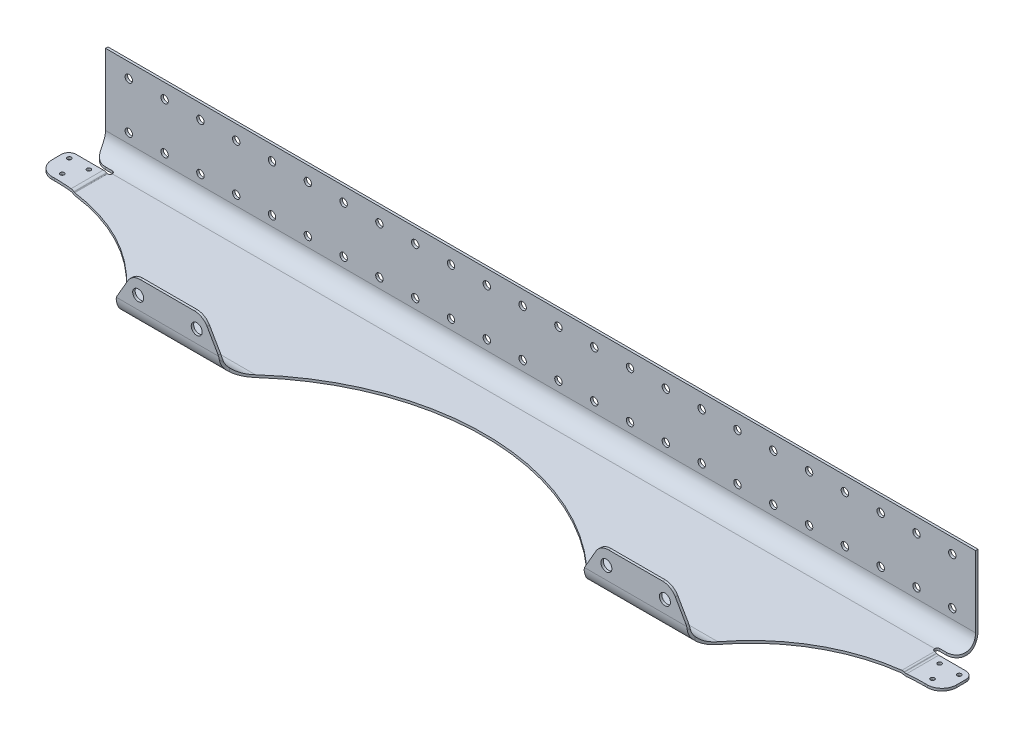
SolidWorks part; units mm, degrees
ref_plane "Front Plane" through (0, 0, 0) normal (1, 0, 0) x (0, 1, 0)
ref_plane "Top Plane" through (0, 0, 0) normal (0, 0, 1) x (0, 1, 0)
ref_plane "Right Plane" through (0, 0, 0) normal (0, 1, 0) x (-1, 0, 0)
sketch "sk 5dia hole pat" plane through (0, 0, 0) normal (0, 0, 1) x (0, 1, 0)
  line L4 (-30.48, -48.26) -> (30.48, -48.26) construction
  point P3 (0, -48.26)
  circle B0 centre (30.48, -579.12) radius 4.826
  circle B1 centre (1188.72, 579.12) radius 4.826
  circle B2 centre (78.74, -579.12) radius 4.826
  circle B3 centre (127, -579.12) radius 4.826
  circle B4 centre (175.26, -579.12) radius 4.826
  circle B5 centre (223.52, -579.12) radius 4.826
  circle B6 centre (271.78, -579.12) radius 4.826
  circle B7 centre (320.04, -579.12) radius 4.826
  circle B8 centre (368.3, -579.12) radius 4.826
  circle B9 centre (416.56, -579.12) radius 4.826
  circle B10 centre (464.82, -579.12) radius 4.826
  circle B11 centre (513.08, -579.12) radius 4.826
  circle B12 centre (561.34, -579.12) radius 4.826
  circle B13 centre (609.6, -579.12) radius 4.826
  circle B14 centre (657.86, -579.12) radius 4.826
  circle B15 centre (706.12, -579.12) radius 4.826
  circle B16 centre (754.38, -579.12) radius 4.826
  circle B17 centre (802.64, -579.12) radius 4.826
  circle B18 centre (850.9, -579.12) radius 4.826
  circle B19 centre (899.16, -579.12) radius 4.826
  circle B20 centre (947.42, -579.12) radius 4.826
  circle B21 centre (995.68, -579.12) radius 4.826
  circle B22 centre (1043.94, -579.12) radius 4.826
  circle B23 centre (1092.2, -579.12) radius 4.826
  circle B24 centre (1140.46, -579.12) radius 4.826
  circle B25 centre (1188.72, -579.12) radius 4.826
  circle B26 centre (30.48, -530.86) radius 4.826
  circle B27 centre (30.48, -482.6) radius 4.826
  circle B28 centre (30.48, -434.34) radius 4.826
  circle B29 centre (30.48, -386.08) radius 4.826
  circle B30 centre (30.48, -337.82) radius 4.826
  circle B31 centre (30.48, -289.56) radius 4.826
  circle B32 centre (30.48, -241.3) radius 4.826
  circle B33 centre (30.48, -193.04) radius 4.826
  circle B34 centre (30.48, -144.78) radius 4.826
  circle B35 centre (30.48, -96.52) radius 4.826
  circle B36 centre (30.48, -48.26) radius 4.826
  circle B37 centre (30.48, 0) radius 4.826
  circle B38 centre (30.48, 48.26) radius 4.826
  circle B39 centre (30.48, 96.52) radius 4.826
  circle B40 centre (30.48, 144.78) radius 4.826
  circle B41 centre (30.48, 193.04) radius 4.826
  circle B42 centre (30.48, 241.3) radius 4.826
  circle B43 centre (30.48, 289.56) radius 4.826
  circle B44 centre (30.48, 337.82) radius 4.826
  circle B45 centre (30.48, 386.08) radius 4.826
  circle B46 centre (30.48, 434.34) radius 4.826
  circle B47 centre (30.48, 482.6) radius 4.826
  circle B48 centre (30.48, 530.86) radius 4.826
  circle B49 centre (30.48, 579.12) radius 4.826
  circle B50 centre (1140.46, 579.12) radius 4.826
  circle B51 centre (1092.2, 579.12) radius 4.826
  circle B52 centre (1043.94, 579.12) radius 4.826
  circle B53 centre (995.68, 579.12) radius 4.826
  circle B54 centre (947.42, 579.12) radius 4.826
  circle B55 centre (899.16, 579.12) radius 4.826
  circle B56 centre (850.9, 579.12) radius 4.826
  circle B57 centre (802.64, 579.12) radius 4.826
  circle B58 centre (754.38, 579.12) radius 4.826
  circle B59 centre (706.12, 579.12) radius 4.826
  circle B60 centre (657.86, 579.12) radius 4.826
  circle B61 centre (609.6, 579.12) radius 4.826
  circle B62 centre (561.34, 579.12) radius 4.826
  circle B63 centre (513.08, 579.12) radius 4.826
  circle B64 centre (464.82, 579.12) radius 4.826
  circle B65 centre (416.56, 579.12) radius 4.826
  circle B66 centre (368.3, 579.12) radius 4.826
  circle B67 centre (320.04, 579.12) radius 4.826
  circle B68 centre (271.78, 579.12) radius 4.826
  circle B69 centre (223.52, 579.12) radius 4.826
  circle B70 centre (175.26, 579.12) radius 4.826
  circle B71 centre (127, 579.12) radius 4.826
  circle B72 centre (78.74, 579.12) radius 4.826
  circle B73 centre (1188.72, 530.86) radius 4.826
  circle B74 centre (1188.72, 482.6) radius 4.826
  circle B75 centre (1188.72, 434.34) radius 4.826
  circle B76 centre (1188.72, 386.08) radius 4.826
  circle B77 centre (1188.72, 337.82) radius 4.826
  circle B78 centre (1188.72, 289.56) radius 4.826
  circle B79 centre (1188.72, 241.3) radius 4.826
  circle B80 centre (1188.72, 193.04) radius 4.826
  circle B81 centre (1188.72, 144.78) radius 4.826
  circle B82 centre (1188.72, 96.52) radius 4.826
  circle B83 centre (1188.72, 48.26) radius 4.826
  circle B84 centre (1188.72, 0) radius 4.826
  circle B85 centre (1188.72, -48.26) radius 4.826
  circle B86 centre (1188.72, -96.52) radius 4.826
  circle B87 centre (1188.72, -144.78) radius 4.826
  circle B88 centre (1188.72, -193.04) radius 4.826
  circle B89 centre (1188.72, -241.3) radius 4.826
  circle B90 centre (1188.72, -289.56) radius 4.826
  circle B91 centre (1188.72, -337.82) radius 4.826
  circle B92 centre (1188.72, -386.08) radius 4.826
  circle B93 centre (1188.72, -434.34) radius 4.826
  circle B94 centre (1188.72, -482.6) radius 4.826
  circle B95 centre (1188.72, -530.86) radius 4.826
  line B96 (609.6, -579.12) -> (609.6, -504.12) construction
  line B97 (30.48, 0) -> (105.48, 0) construction
  circle B98 centre (-30.48, 579.12) radius 4.826
  circle B99 centre (-175.26, -579.12) radius 4.826
  circle B100 centre (-127, -579.12) radius 4.826
  circle B101 centre (-30.48, -579.12) radius 4.826
  circle B102 centre (-1188.72, 96.52) radius 4.826
  circle B103 centre (-127, 579.12) radius 4.826
  circle B104 centre (-464.82, 579.12) radius 4.826
  circle B105 centre (-513.08, 579.12) radius 4.826
  circle B106 centre (-706.12, 579.12) radius 4.826
  circle B107 centre (-754.38, 579.12) radius 4.826
  circle B108 centre (-899.16, 579.12) radius 4.826
  circle B109 centre (-30.48, 530.86) radius 4.826
  circle B110 centre (-30.48, 482.6) radius 4.826
  circle B111 centre (-30.48, 434.34) radius 4.826
  circle B112 centre (-30.48, 386.08) radius 4.826
  circle B113 centre (-30.48, 337.82) radius 4.826
  circle B114 centre (-30.48, 289.56) radius 4.826
  circle B115 centre (-30.48, 241.3) radius 4.826
  circle B116 centre (-30.48, 193.04) radius 4.826
  circle B117 centre (-30.48, 144.78) radius 4.826
  circle B118 centre (-30.48, 96.52) radius 4.826
  circle B119 centre (-30.48, 48.26) radius 4.826
  circle B120 centre (-30.48, 0) radius 4.826
  circle B121 centre (-30.48, -48.26) radius 4.826
  circle B122 centre (-30.48, -96.52) radius 4.826
  circle B123 centre (-30.48, -144.78) radius 4.826
  circle B124 centre (-30.48, -241.3) radius 4.826
  circle B125 centre (-30.48, -289.56) radius 4.826
  circle B126 centre (-30.48, -337.82) radius 4.826
  circle B127 centre (-30.48, -386.08) radius 4.826
  circle B128 centre (-30.48, -434.34) radius 4.826
  circle B129 centre (-30.48, -482.6) radius 4.826
  circle B130 centre (-30.48, -530.86) radius 4.826
  line B131 (-1188.72, 0) -> (-1113.72, 0) construction
  dimension "D1" = 60.96
sketch_block_instance "5dia hole pat-1"
sketch_block "5dia hole pat" parameters "D1"=9.652, "D2"=9.652, "D3"=75
sketch_block_instance "5dia hole pat-2"
sketch "sk 47.986in pnl" plane through (0, 0, 0) normal (0, 0, 1) x (0, 1, 0)
  line B0 (0.1778, 0) -> (1219.0222, 0) construction
  line B1 (0.1778, 609.4222) -> (1219.0222, 609.4222)
  line B2 (0.1778, 609.4222) -> (0.1778, -609.4222)
  line B3 (0.1778, -609.4222) -> (1219.0222, -609.4222)
  line B4 (1219.0222, 609.4222) -> (1219.0222, -609.4222)
  line B5 (609.6, 609.4222) -> (609.6, -609.4222) construction
  dimension "D1" = 30.3022
sketch_block_instance "47.986in pnl-1"
sketch_block "47.986in pnl" parameters "D1"=1218.8444, "D2"=1218.8444
sketch "sk main body" plane through (0, 0, 0) normal (1, 0, 0) x (0, 1, 0)
  line L0 (49.53, 0) -> (-43.18, 0)
  line L1 (-68.58, 25.4) -> (-68.58, 158.75)
  line L2 (-43.18, 184.15) -> (-7.62, 184.15)
  line L3 (-26.67, 213.8401) -> (-26.67, 147.2198) construction
  line L4 (49.53, 3.175) -> (-43.18, 3.175)
  line L5 (-65.405, 25.4) -> (-65.405, 158.75)
  line L6 (-43.18, 180.975) -> (-7.62, 180.975)
  line L7 (-7.62, 184.15) -> (-7.62, 180.975)
  line L8 (49.53, 3.175) -> (49.53, 0)
  line L9 (670.3644, 0) -> (-670.3644, 0) construction
  arc A0 (-43.18, 0) -> (-68.58, 25.4) centre (-43.18, 25.4) cw
  arc A1 (-68.58, 158.75) -> (-43.18, 184.15) centre (-43.18, 158.75) cw
  arc A2 (-43.18, 3.175) -> (-65.405, 25.4) centre (-43.18, 25.4) cw
  arc A3 (-65.405, 158.75) -> (-43.18, 180.975) centre (-43.18, 158.75) cw
  dimension "D2" = 25.4
  dimension "D1" = 19.05
  dimension "D3" = 12.7
  dimension "D4" = 16.51
  dimension "D5" = 19.05
  dimension "D7" = 177.8
  dimension "D6" = 3.175
extrude "main body" add sketch "sk main body" along normal mid plane 1132.8
sketch "sk upper holes" plane through (0, 0, 184.15) normal (0, 0, 1) x (1, 0, 0)
  line L0 (-609.4222, 0.1778) -> (-609.4222, 1219.0222) construction
  line L1 (609.4222, 0.1778) -> (609.4222, 1219.0222) construction
  line L2 (566.4, -7.62) -> (-566.4, -7.62) construction
  circle A2 centre (-342.9, -26.67) radius 16.51 construction
  circle A3 centre (-266.7, -26.67) radius 16.51 construction
  circle A4 centre (266.7, -26.67) radius 16.51 construction
  circle A5 centre (342.9, -26.67) radius 16.51 construction
  line B0 (-342.9, -26.67) -> (-266.7, -26.67) construction
  circle B1 centre (-342.9, -26.67) radius 7.1438
  circle B2 centre (-266.7, -26.67) radius 7.1438
  line B3 (266.7, -26.67) -> (342.9, -26.67) construction
  circle B4 centre (266.7, -26.67) radius 7.1438
  circle B5 centre (342.9, -26.67) radius 7.1438
  dimension "D1" = 304.8
  dimension "D2" = 304.8
  dimension "D6" = 33.02
  dimension "D7" = 33.02
  dimension "D8" = 33.02
  dimension "D9" = 33.02
  dimension "D3" = 304.6222
  dimension "D4" = 304.6222
  dimension "D5" = 19.05
sketch_block_instance "Upper bolt holes-1"
sketch_block "Upper bolt holes" parameters "D1"=14.2875, "D2"=14.2875, "D3"=76.2
sketch_block_instance "Upper bolt holes-2"
sketch "Sketch6" plane through (0, 0, 184.15) normal (0, 0, 1) x (1, 0, 0)
  line L0 (-371.4962, -43.18) -> (-304.8, 72.3411)
  line L1 (566.4, -43.18) -> (-566.4, -43.18) construction
  line L2 (-304.8, 72.3411) -> (-238.1038, -43.18)
  line L3 (-371.4962, -43.18) -> (-638.8127, -43.18)
  line L4 (-638.8127, -43.18) -> (-638.8127, 115.8831)
  line L6 (238.1038, -43.18) -> (304.8, 72.3411)
  line L7 (304.8, 72.3411) -> (371.4962, -43.18)
  line L8 (371.4962, -43.18) -> (645.1619, -43.18)
  line L9 (645.1619, -43.18) -> (645.1619, 115.8831)
  line L10 (-238.1038, -43.18) -> (238.1038, -43.18)
  line L11 (-638.8127, 115.8831) -> (645.1619, 115.8831)
  circle A0 centre (-342.9, -26.67) radius 16.51 construction
  circle A1 centre (-266.7, -26.67) radius 16.51 construction
  circle A2 centre (342.9, -26.67) radius 16.51 construction
  circle A3 centre (266.7, -26.67) radius 16.51 construction
  dimension "D1" = 60
  dimension "D2" = 60
  dimension "D3" = 60
  dimension "D4" = 60
extrude "Upper tabs" cut sketch "Sketch6" against normal blind 10
sketch "Sketch7" plane through (0, 0, 0) normal (0, 1, 0) x (-1, 0, 0)
  line L0 (-238.1038, 180.975) -> (-238.1038, 196.2087)
  line L4 (-238.1038, 196.2087) -> (238.1038, 196.2087)
  line L5 (238.1038, 196.2087) -> (238.1038, 180.975)
  line L6 (-566.4, 25.4) -> (566.4, 25.4) construction
  arc A2 (-238.1038, 180.975) -> (238.1038, 180.975) centre (0, 399.136) ccw
  point P2 (0, 76.2)
  dimension "D1" = 50.8
extrude "Side Mid curve" cut sketch "Sketch7" against normal through all
sketch "5dia hole for part" plane through (0, 0, 0) normal (0, 0, 1) x (0, 1, 0)
  line L0 (49.53, -566.4) -> (-43.18, -566.4) construction
  line L1 (49.53, -566.4) -> (49.53, 566.4) construction
  line L2 (-43.18, -566.4) -> (-43.18, 566.4) construction
  circle A52 centre (-30.48, -536.0978) radius 4.826
  circle A53 centre (30.48, -536.0978) radius 4.826
  circle A54 centre (30.48, -489.4806) radius 4.826
  circle A55 centre (-30.48, -489.4806) radius 4.826
  circle A56 centre (30.48, -442.8634) radius 4.826
  circle A57 centre (-30.48, -442.8634) radius 4.826
  circle A58 centre (30.48, -396.2462) radius 4.826
  circle A59 centre (-30.48, -396.2462) radius 4.826
  circle A60 centre (30.48, -349.629) radius 4.826
  circle A61 centre (-30.48, -349.629) radius 4.826
  circle A62 centre (30.48, -303.0118) radius 4.826
  circle A63 centre (-30.48, -303.0118) radius 4.826
  circle A64 centre (30.48, -256.3946) radius 4.826
  circle A65 centre (-30.48, -256.3946) radius 4.826
  circle A66 centre (30.48, -209.7774) radius 4.826
  circle A67 centre (-30.48, -209.7774) radius 4.826
  circle A68 centre (30.48, -163.1602) radius 4.826
  circle A69 centre (-30.48, -163.1602) radius 4.826
  circle A70 centre (30.48, -116.543) radius 4.826
  circle A71 centre (-30.48, -116.543) radius 4.826
  circle A72 centre (30.48, -69.9258) radius 4.826
  circle A73 centre (-30.48, -69.9258) radius 4.826
  circle A74 centre (30.48, -23.3086) radius 4.826
  circle A75 centre (-30.48, -23.3086) radius 4.826
  circle A76 centre (30.48, 23.3086) radius 4.826
  circle A77 centre (-30.48, 23.3086) radius 4.826
  circle A78 centre (30.48, 69.9258) radius 4.826
  circle A79 centre (-30.48, 69.9258) radius 4.826
  circle A80 centre (30.48, 116.543) radius 4.826
  circle A81 centre (-30.48, 116.543) radius 4.826
  circle A82 centre (30.48, 163.1602) radius 4.826
  circle A83 centre (-30.48, 163.1602) radius 4.826
  circle A84 centre (30.48, 209.7774) radius 4.826
  circle A85 centre (-30.48, 209.7774) radius 4.826
  circle A86 centre (30.48, 256.3946) radius 4.826
  circle A87 centre (-30.48, 256.3946) radius 4.826
  circle A88 centre (30.48, 303.0118) radius 4.826
  circle A89 centre (-30.48, 303.0118) radius 4.826
  circle A90 centre (30.48, 349.629) radius 4.826
  circle A91 centre (-30.48, 349.629) radius 4.826
  circle A92 centre (30.48, 396.2462) radius 4.826
  circle A93 centre (-30.48, 396.2462) radius 4.826
  circle A94 centre (30.48, 442.8634) radius 4.826
  circle A95 centre (-30.48, 442.8634) radius 4.826
  circle A96 centre (30.48, 489.4806) radius 4.826
  circle A97 centre (-30.48, 489.4806) radius 4.826
  circle A98 centre (30.48, 536.0978) radius 4.826
  circle A99 centre (-30.48, 536.0978) radius 4.826
  dimension "D4" = 9.652
  dimension "D5" = 9.652
  dimension "D1" = 30.3022
  dimension "D2" = 19.05
  dimension "D3" = 12.7
  dimension "D6" = 24
extrude "Holes Bot" cut sketch "5dia hole for part" along normal blind 10
extrude "Holes Top" cut sketch "sk upper holes" against normal blind 10
ref_plane "Tab Lower pln" through (0, 0, 25.4) normal (0, 0, 1) x (0, 1, 0)
sketch "sk Rivet holes" plane through (0, 0, 0) normal (0, 1, 0) x (-1, 0, 0)
  line L1 (566.4, 0) -> (566.4, 3.175) construction
  line L3 (64.9605, 25.4) -> (-64.9605, 25.4) construction
  line L5 (-566.4, 25.4) -> (-566.4, 158.75) construction
  circle A0 centre (579.2778, 37.4) radius 10 construction
  circle A1 centre (566.5778, 59.397) radius 10 construction
  circle A2 centre (553.8778, 37.4) radius 10 construction
  circle A3 centre (-566.5778, 59.397) radius 10 construction
  circle A4 centre (-553.8778, 37.4) radius 10 construction
  circle A6 centre (-579.2778, 37.4) radius 10 construction
  point P5 (579.2778, 34.8092)
  point P9 (579.2778, 27.4)
  point P20 (589.2778, 37.4)
  point P21 (-589.2778, 37.4)
  point P22 (543.8778, 37.4)
  point P23 (-543.8778, 37.4)
  point P24 (566.5778, 69.397)
  point P25 (-566.5778, 69.397)
  line B0 (553.8778, 37.4) -> (566.5778, 59.397) construction
  line B1 (566.5778, 59.397) -> (579.2778, 37.4) construction
  line B2 (579.2778, 37.4) -> (553.8778, 37.4) construction
  circle B3 centre (553.8778, 37.4) radius 2.5908
  circle B4 centre (579.2778, 37.4) radius 2.5908
  circle B5 centre (566.5778, 59.397) radius 2.5908
  line B6 (560.2278, 48.3985) -> (566.5778, 44.7323) construction
  line B7 (566.5778, 37.4) -> (566.5778, 44.7323) construction
  line B8 (-579.2778, 37.4) -> (-566.5778, 59.397) construction
  line B9 (-566.5778, 59.397) -> (-553.8778, 37.4) construction
  line B10 (-553.8778, 37.4) -> (-579.2778, 37.4) construction
  circle B11 centre (-579.2778, 37.4) radius 2.5908
  circle B12 centre (-553.8778, 37.4) radius 2.5908
  circle B13 centre (-566.5778, 59.397) radius 2.5908
  line B14 (-572.9278, 48.3985) -> (-566.5778, 44.7323) construction
  line B15 (-566.5778, 37.4) -> (-566.5778, 44.7323) construction
  dimension "D4" = 20
  dimension "D6" = 20
  dimension "D7" = 20
  dimension "D8" = 20
  dimension "D9" = 20
  dimension "D10" = 20
  dimension "D1" = 0.1778
  dimension "D2" = 12
  dimension "D3" = 0.1778
  dimension "D5" = 7.4092
sketch_block_instance "Blind Rivet holes-1"
sketch_block "Blind Rivet holes" parameters "D1"=5.1816, "D2"=5.1816, "D3"=5.1816, "D4"=60, "D5"=60, "D6"=25.4, "D7"=25.4, "D8"=25.4
sketch_block_instance "Blind Rivet holes-2"
sketch "sk Vtab" plane through (0, 0, 25.4) normal (0, 0, 1) x (0, 1, 0)
  line L8 (-68.58, -566.4) -> (-68.58, 566.4) construction
  line B0 (-68.58, 536.4487) -> (-68.58, 538.4487)
  line B1 (-67.9101, 540.9487) -> (-67.6624, 541.3778)
  line B2 (-66.9925, 543.8778) -> (-66.9925, 588.8778)
  line B3 (-65.405, 536.4487) -> (-65.405, 538.4487)
  line B4 (-65.1605, 539.3612) -> (-64.9127, 539.7903)
  line B5 (-63.8175, 543.8778) -> (-63.8175, 588.8778)
  line B6 (-68.58, 536.4487) -> (-65.405, 536.4487)
  line B7 (-63.8175, 588.8778) -> (-66.9925, 588.8778)
  arc B8 (-67.6624, 541.3778) -> (-66.9925, 543.8778) centre (-71.9925, 543.8778) ccw
  arc B9 (-68.58, 538.4487) -> (-67.9101, 540.9487) centre (-63.58, 538.4487) cw
  arc B10 (-65.405, 538.4487) -> (-65.1605, 539.3612) centre (-63.58, 538.4487) cw
  arc B11 (-64.9127, 539.7903) -> (-63.8175, 543.8778) centre (-71.9925, 543.8778) ccw
  line B12 (-65.405, -536.4487) -> (-65.405, -538.4487)
  line B13 (-66.0749, -540.9487) -> (-66.3226, -541.3778)
  line B14 (-66.9925, -543.8778) -> (-66.9925, -588.8778)
  line B15 (-68.58, -536.4487) -> (-68.58, -538.4487)
  line B16 (-68.8245, -539.3612) -> (-69.0723, -539.7903)
  line B17 (-70.1675, -543.8778) -> (-70.1675, -588.8778)
  line B18 (-65.405, -536.4487) -> (-68.58, -536.4487)
  line B19 (-70.1675, -588.8778) -> (-66.9925, -588.8778)
  arc B20 (-66.3226, -541.3778) -> (-66.9925, -543.8778) centre (-61.9925, -543.8778) ccw
  arc B21 (-65.405, -538.4487) -> (-66.0749, -540.9487) centre (-70.405, -538.4487) cw
  arc B22 (-68.58, -538.4487) -> (-68.8245, -539.3612) centre (-70.405, -538.4487) cw
  arc B23 (-69.0723, -539.7903) -> (-70.1675, -543.8778) centre (-61.9925, -543.8778) ccw
sketch_block_instance "V tab-1"
sketch_block "V tab" parameters "D3"=5, "D1"=30, "D2"=1.5875, "D4"=2, "D5"=24.625
sketch_block_instance "V tab-2"
sketch "sk Vtab precut" plane through (0, 0, 25.4) normal (0, 0, 1) x (0, 1, 0)
  line L1 (-68.58, 538.4487) -> (-25.5629, 538.4487)
  line L2 (-68.58, 538.4487) -> (-68.58, 628.7058)
  line L3 (-68.58, 628.7058) -> (-25.5629, 628.7058)
  line L4 (-25.5629, 538.4487) -> (-25.5629, 628.7058)
  line L5 (-68.58, -538.4487) -> (-35.8904, -538.4487)
  line L6 (-68.58, -538.4487) -> (-68.58, -622.8382)
  line L7 (-68.58, -622.8382) -> (-35.8904, -622.8382)
  line L8 (-35.8904, -538.4487) -> (-35.8904, -622.8382)
sketch "Sketch9" plane through (0, 0, 0) normal (0, 1, 0) x (-1, 0, 0)
  line L6 (371.4962, 180.975) -> (371.4962, 193.3104)
  line L7 (371.4962, 193.3104) -> (736.1624, 193.3104)
  line L8 (736.1624, 193.3104) -> (736.1624, 69.397)
  line L9 (736.1624, 69.397) -> (566.5778, 69.397)
  line L10 (-371.4962, 180.975) -> (-371.4962, 190.6931)
  line L11 (-371.4962, 190.6931) -> (-686.7988, 190.6931)
  line L12 (-686.7988, 190.6931) -> (-686.7988, 69.397)
  line L13 (-686.7988, 69.397) -> (-566.5778, 69.397)
  arc A2 (371.4962, 180.975) -> (566.5778, 69.397) centre (566.5778, 295.7253) ccw
  arc A3 (-371.4962, 180.975) -> (-566.5778, 69.397) centre (-566.5778, 295.7253) cw
  circle A4 centre (-566.5778, 59.397) radius 10 construction
extrude "Cut-Extrude5" cut sketch "sk Vtab precut" along normal through all
extrude "Side Tabs" add sketch "sk Vtab" along normal blind 50
sketch "Sketch11" plane through (0, 0, 0) normal (0, 1, 0) x (-1, 0, 0)
  line L0 (538.4487, 25.4) -> (667.6325, 25.4) construction
  line L1 (538.4487, 28.575) -> (667.6325, 28.575)
  line L2 (538.4487, 22.225) -> (667.6325, 22.225)
  line L4 (-538.4487, 25.4) -> (538.4487, 25.4) construction
  line L5 (538.4487, 75.4) -> (538.4487, 25.4) construction
  line L6 (-538.4487, 25.4) -> (-658.6998, 25.4) construction
  line L7 (-538.4487, 22.225) -> (-658.6998, 22.225)
  line L8 (-538.4487, 28.575) -> (-658.6998, 28.575)
  line L9 (-538.4487, 25.4) -> (-538.4487, 75.4) construction
  arc A0 (538.4487, 28.575) -> (538.4487, 22.225) centre (538.4487, 25.4) ccw
  arc A1 (667.6325, 22.225) -> (667.6325, 28.575) centre (667.6325, 25.4) ccw
  arc A2 (-538.4487, 22.225) -> (-538.4487, 28.575) centre (-538.4487, 25.4) ccw
  arc A3 (-658.6998, 28.575) -> (-658.6998, 22.225) centre (-658.6998, 25.4) ccw
  point P2 (603.0406, 25.4)
  point P7 (-598.5742, 25.4)
  dimension "D1" = 3.175
  dimension "D2" = 3.175
extrude "tab undercut" cut sketch "Sketch11" against normal through all
extrude "Outer curve cut" cut sketch "Sketch9" against normal through all
fillet "Fillet1" radius 19.05 12 edges at (-566.4, -66.7789, 22.225) (566.4, -66.7789, 22.225) (588.8778, -68.58, 69.397) (-588.8778, -65.405, 69.397) (-371.4962, -49.3284, 180.975) (-238.1038, -49.3284, 180.975) (371.4962, -49.3284, 180.975) (238.1038, -49.3284, 180.975) (350.9656, -7.62, 182.5625) (258.6344, -7.62, 182.5625) (-258.6344, -7.62, 182.5625) (-350.9656, -7.62, 182.5625)
fillet "Fillet3" radius 9.525 6 edges at (588.8778, -68.58, 28.575) (-588.8778, -65.405, 28.575) (237.1094, -44.9024, 182.4383) (371.8703, -43.828, 182.5283) (-237.1094, -44.9024, 182.4383) (-371.8703, -43.828, 182.5283)
extrude "Tab Holes" cut sketch "sk Rivet holes" against normal through all
equation "\"3i\"=138.375"
equation "\".75i\"=12.7"
